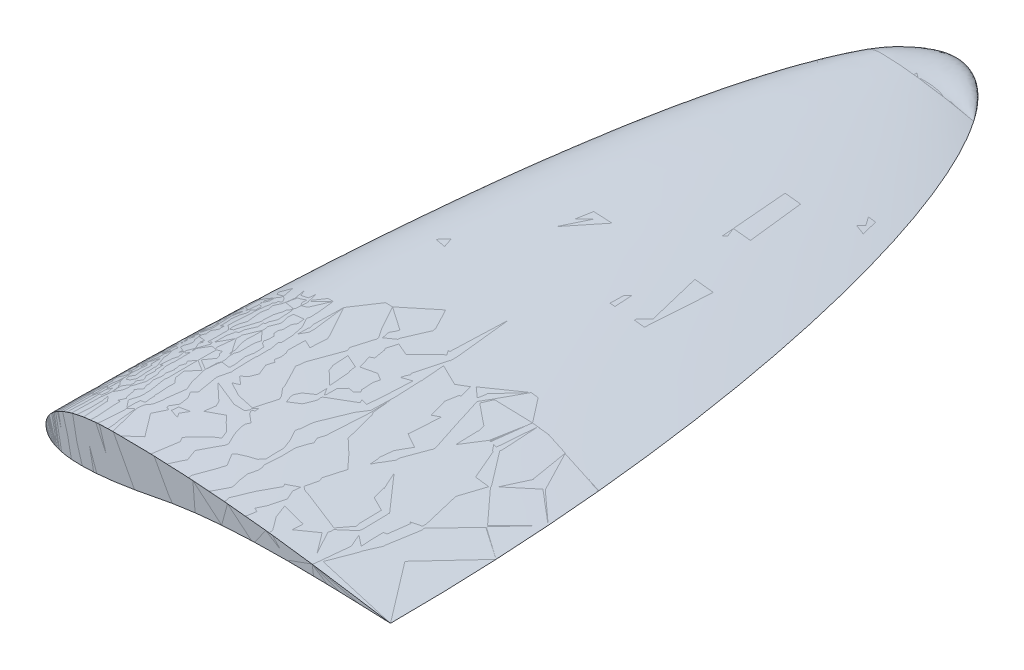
SolidWorks part; units mm, degrees
ref_plane "Vorne" through (0, 0, 0) normal (0, 0, 1) x (1, 0, 0)
ref_plane "Oben" through (0, 0, 0) normal (0, 1, 0) x (1, 0, 0)
ref_plane "Seite" through (0, 0, 0) normal (1, 0, 0) x (0, 0, -1)
sketch "Skizze1" plane through (0, 0, 0) normal (0, 0, 1) x (1, 0, 0)
  line L0 (-68.1532, 0) -> (97.8466, 0) construction
  line L1 (-68.1532, 11.0858) -> (-68.1532, -11.0858) construction
  line L2 (-28.0141, 13.1723) -> (-55.7179, 13.1723) construction
  point P5 (-36.1411, 13.1723)
  point P7 (16.4095, 10.8929)
  point P12 (-41.4826, -8.0982)
  point P14 (-7.436, -2.5623)
sketch "Skizze2" plane through (0, 0, 0) normal (0, 1, 0) x (1, 0, 0)
  line L3 (-16.0533, 371.346) -> (-39.683, 371.346) construction
  line L4 (-68.1532, 0.9536) -> (-68.1532, -16.6481) construction
  line L5 (97.8466, -2.7034) -> (97.8466, 27.0203) construction
  line L6 (0, 0) -> (0, 391.4827) construction
  point P0 (-68.1532, 0)
  point P1 (0, 371.346)
  point P3 (97.8466, 0)
  dimension "D1" = 280
ref_plane "Ebene1" through (0, 0, -350) normal (0, 0, 1) x (1, 0, 0)
sketch "Skizze3" plane through (0, 0, -350) normal (0, 0, 1) x (1, 0, 0)
  line L0 (-25.2141, 0) -> (28.8499, 0) construction
  line L4 (-25.2141, 4.3886) -> (-25.2141, -4.3886) construction
  line L5 (-11.8488, 6.1224) -> (-20.9023, 6.1224) construction
  point P8 (-11.0299, -3.664)
  point P9 (-16.1438, 6.1224)
  point P11 (7.0287, 4.0795)
  point P12 (8.1711, -0.9563)
sketch "Skizze4" plane through (0, 0, 0) normal (0, 1, 0) x (1, 0, 0)
  line L0 (0, 0) -> (0, 391.4827) construction
  line L1 (0, 0) -> (0, 391.4827) construction
  point P2 (-68.1532, 0)
  point P3 (97.8466, 0)
  point P4 (0, 371.346)
sketch "Skizze5" plane through (0, 0, 0) normal (0, 1, 0) x (1, 0, 0)
  line L0 (0, 0) -> (0, 391.4827) construction
  line L1 (0, 0) -> (0, 391.4827) construction
  point P2 (-68.1532, 0)
  point P3 (97.8466, 0)
  point P4 (0, 371.346)
loft "Ausformung1" add profiles "Skizze1", "Skizze3"
ref_plane "Ebene2" through (0, 0, -371.346) normal (0, 0, 1) x (1, 0, 0)
sketch "Skizze6" plane through (0, 0, -371.346) normal (0, 0, 1) x (1, 0, 0)
  point P0 (0, 0)
sketch "Skizze7" plane through (0, 0, 0) normal (0, 1, 0) x (1, 0, 0)
  line L0 (28.8499, 350) -> (-25.2141, 350) construction
  line L1 (-14.8201, 350) -> (14.8201, 350) construction
  point P0 (-68.1532, 0)
  point P1 (97.8466, 0)
surface "Oberfläche-Linear austragen1" sketch "Skizze7" parameters "D1"=25
sketch3d "3D-Skizze1"
  line L0 (0, 0, -371.346) -> (0, -25, -371.346)
  line L1 (0, 0, -371.346) -> (0, -25, -371.346) construction
  point P1 (0, 5.0515, -350)
  point P2 (0, 12.1278, 0)
sketch "Skizze8" plane through (0, 0, 0) normal (1, 0, 0) x (0, 0, -1)
  line L0 (371.346, 0) -> (371.346, -25) construction
  point P0 (371.346, 0)
  point P1 (350, 5.0515)
  point P2 (350, 5.0515)
  point P3 (0, 12.1278)
sketch "Skizze9" plane through (0, 0, 0) normal (0, 1, 0) x (1, 0, 0)
  point P0 (-25.2141, 350)
  point P1 (28.8499, 350)
surface "Oberfläche-Linear austragen2" sketch "Skizze9" parameters "D1"=25
sketch3d "3D-Skizze3"
  line L0 (0, 25, -371.346) -> (0, 0, -371.346)
  line L1 (0, 25, -371.346) -> (0, 0, -371.346)
  point P0 (-404.6983, 443.8761, 0)
  point P1 (0, -1.4316, 0)
  point P2 (0, -1.9813, -350)
sketch "Skizze10" plane through (0, 0, 0) normal (1, 0, 0) x (0, 0, -1)
  line L1 (371.346, 25) -> (371.346, 0) construction
  point P0 (371.346, 0)
  point P1 (350, -1.9813)
  point P6 (0, -1.4316)
  point P7 (350, -1.9813)
surface "Oberflächenausfüllung1"
surface "Oberflächenausfüllung5"
surface "Oberfläche-Zusammenfügen1"
